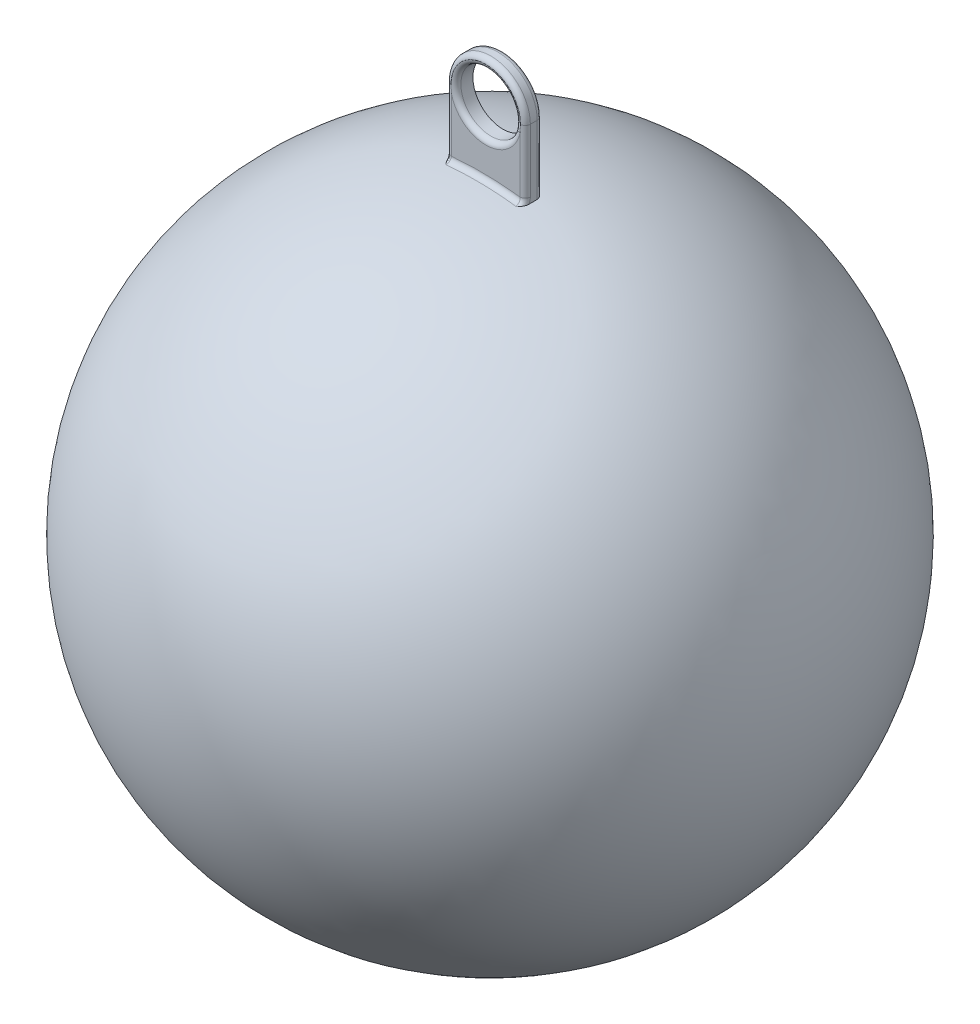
SolidWorks part; units mm, degrees
ref_plane "Front Plane" through (0, 0, 0) normal (0, 0, 1) x (1, 0, 0)
ref_plane "Top Plane" through (0, 0, 0) normal (0, 1, 0) x (1, 0, 0)
ref_plane "Right Plane" through (0, 0, 0) normal (1, 0, 0) x (0, 0, -1)
sketch "Sketch1" plane through (0, 0, 0) normal (0, 0, 1) x (1, 0, 0)
  line L0 (-17.3735, 114.4202) -> (-17.3735, 96.1302)
  arc A2 (-17.3735, 114.4202) -> (-17.3735, 96.1302) centre (-17.3735, 105.2752) ccw
  point P3 (0, 0)
  point P4 (0, 0)
  dimension "D1" = 9.145
revolve "Revolve1" add sketch "Sketch1" angle 360 about L0
sketch "Sketch2" plane through (0, 0, 0) normal (0, 0, 1) x (1, 0, 0)
  line L1 (-18.395, 116.3304) -> (-18.395, 114.3304)
  line L2 (-18.395, 114.3304) -> (-16.095, 114.3304)
  line L3 (-16.095, 114.3304) -> (-16.095, 116.3304)
  circle A4 centre (-17.245, 116.3304) radius 0.875
  arc A5 (-16.095, 116.3304) -> (-18.395, 116.3304) centre (-17.245, 116.3304) ccw
  circle A6 centre (-17.3735, 105.2752) radius 9.145 construction
  point P3 (-18.5268, 116.0012)
  point P8 (-16.1185, 114.3337)
  point P11 (-18.4185, 114.0753)
  point P12 (0, 0)
  point P13 (-17.7953, 115.8386)
  point P14 (-18.395, 116.2985)
  dimension "D1" = 1.75
  dimension "D2" = 2.3
  dimension "D3" = 2
extrude "Boss-Extrude1" add sketch "Sketch2" along normal mid plane 0.5
fillet "Fillet7" [suppressed] radius 0.15
fillet "Fillet8" radius 0.15 1 edges at (-17.2564, 114.416, 0.25)
fillet "Fillet9" radius 0.15 9 edges at (-16.095, 114.3778, 0.2834) (-18.395, 114.3912, 0.3017) (-16.095, 115.3304, -0.25) (-17.245, 117.4804, -0.25) (-16.37, 116.3304, 0.25) (-17.245, 117.4804, 0.25) (-16.095, 115.4018, 0.25) (-18.395, 115.4178, 0.25) (-18.395, 115.345, -0.25)
